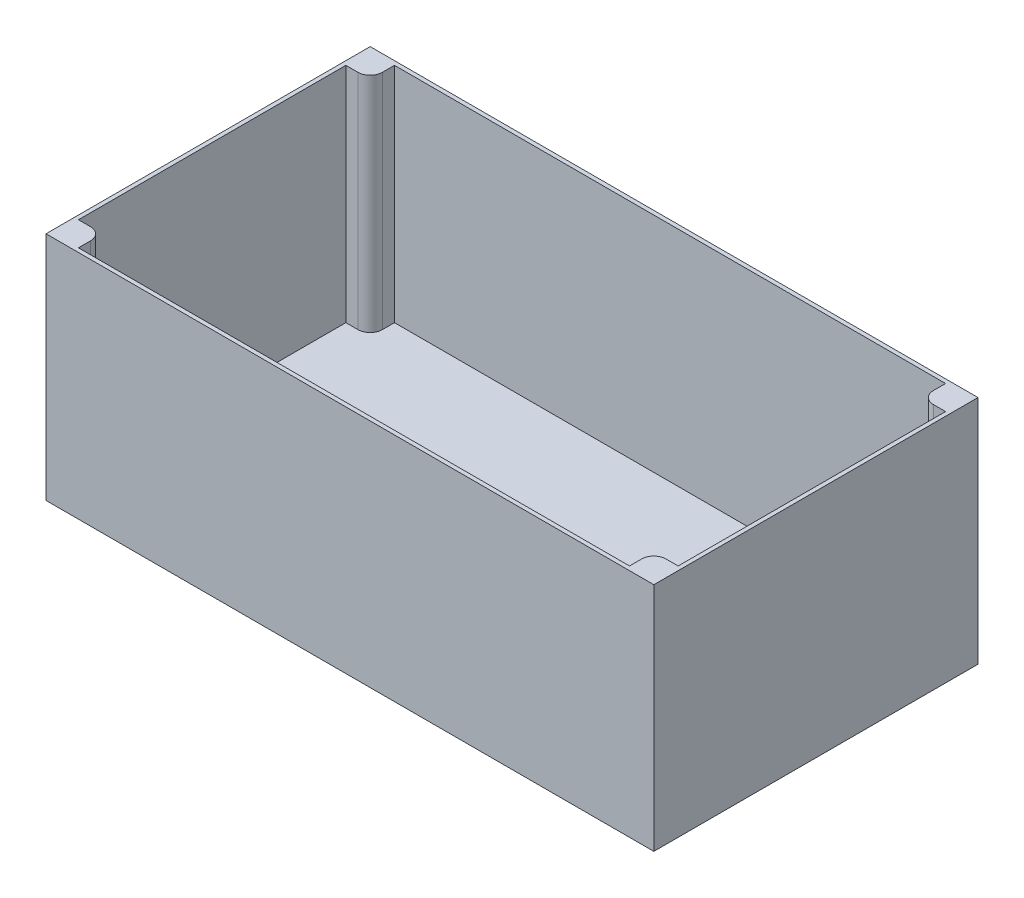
SolidWorks part; units mm, degrees
ref_plane "Спереди" through (0, 0, 0) normal (0, 0, 1) x (1, 0, 0)
ref_plane "Сверху" through (0, 0, 0) normal (0, 1, 0) x (1, 0, 0)
ref_plane "Справа" through (0, 0, 0) normal (1, 0, 0) x (0, 0, -1)
sketch "Эскиз1" plane through (0, 0, 0) normal (0, 1, 0) x (1, 0, 0)
  line L1 (-75, -40) -> (75, -40)
  line L2 (-75, -40) -> (-75, 40)
  line L3 (-75, 40) -> (75, 40)
  line L4 (75, -40) -> (75, 40)
  line L5 (-75, -40) -> (75, 40) construction
  line L6 (-75, 40) -> (75, -40) construction
  point P0 (0, 0)
  dimension "D1" = 150
  dimension "D2" = 80
extrude "Бобышка-Вытянуть1" add sketch "Эскиз1" along normal blind 2
sketch "Эскиз2" plane through (0, 2, 0) normal (0, 1, 0) x (1, 0, 0)
  line L1 (-74, -39) -> (74, -39)
  line L2 (-74, -39) -> (-74, 39)
  line L3 (-74, 39) -> (74, 39)
  line L4 (74, -39) -> (74, 39)
  line L5 (-74, -39) -> (74, 39) construction
  line L6 (-74, 39) -> (74, -39) construction
  line L7 (-75, -40) -> (75, -40)
  line L8 (-75, -40) -> (-75, 40)
  line L9 (-75, 40) -> (75, 40)
  line L10 (75, -40) -> (75, 40)
  line L11 (-75, -40) -> (75, 40) construction
  line L12 (-75, 40) -> (75, -40) construction
  point P0 (0, 0)
  point P6 (0, 0)
  dimension "D1" = 1
  dimension "D2" = 1
extrude "Бобышка-Вытянуть2" add sketch "Эскиз2" along normal blind 55
sketch "Эскиз3" plane through (0, 2, 0) normal (0, 1, 0) x (1, 0, 0)
  line L0 (-74, -39) -> (74, -39) construction
  line L1 (-74, 39) -> (-68, 39)
  line L2 (-74, 39) -> (-74, 33)
  line L3 (-74, 33) -> (-68, 33)
  line L4 (-68, 39) -> (-68, 33)
  line L5 (-74, -39) -> (-68, -39)
  line L6 (-74, -39) -> (-74, -33)
  line L7 (-74, -33) -> (-68, -33)
  line L8 (-68, -39) -> (-68, -33)
  line L9 (74, 39) -> (68, 39)
  line L10 (74, 39) -> (74, 33)
  line L11 (74, 33) -> (68, 33)
  line L12 (68, 39) -> (68, 33)
  line L13 (68, -39) -> (74, -39)
  line L14 (68, -39) -> (68, -33)
  line L15 (68, -33) -> (74, -33)
  line L16 (74, -39) -> (74, -33)
  line L17 (74, -39) -> (74, 39) construction
  dimension "D1" = 6
extrude "Бобышка-Вытянуть3" add sketch "Эскиз3" along normal up to surface (55 mm away)
fillet "Скругление1" radius 3 4 edges at (-68, 29.5, 33) (68, 29.5, 33) (68, 29.5, -33) (-68, 29.5, -33)
